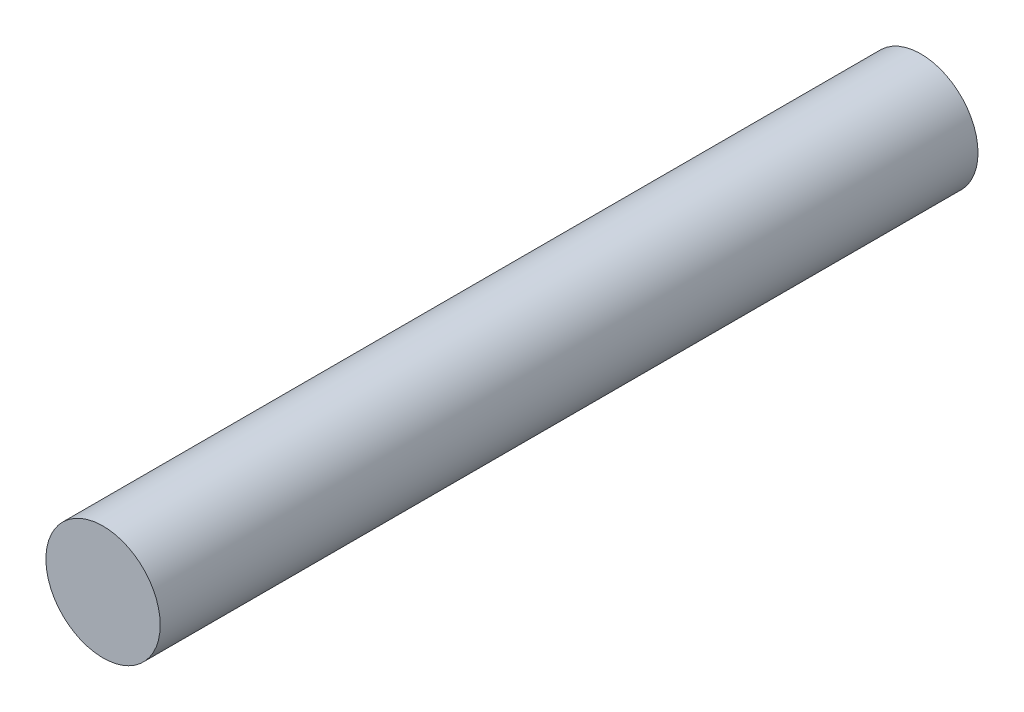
SolidWorks part; units mm, degrees
ref_plane "Front Plane" through (0, 0, 0) normal (0, 0, 1) x (1, 0, 0)
ref_plane "Top Plane" through (0, 0, 0) normal (0, 1, 0) x (1, 0, 0)
ref_plane "Right Plane" through (0, 0, 0) normal (1, 0, 0) x (0, 0, -1)
sketch "Sketch1" plane through (0, 0, 0) normal (0, 1, 0) x (1, 0, 0)
  line L0 (0, 0) -> (0, 30) construction
  line L1 (0, 41.547) -> (0, 30) construction
  line L2 (0, 41.547) -> (0, 71.547) construction
sketch "Sketch2" plane through (0, 0, 0) normal (0, 0, 1) x (1, 0, 0)
  circle A0 centre (0, 0) radius 5
extrude "Boss-Extrude2" add sketch "Sketch2" against normal up to vertex (71.547 mm away) contours A0
